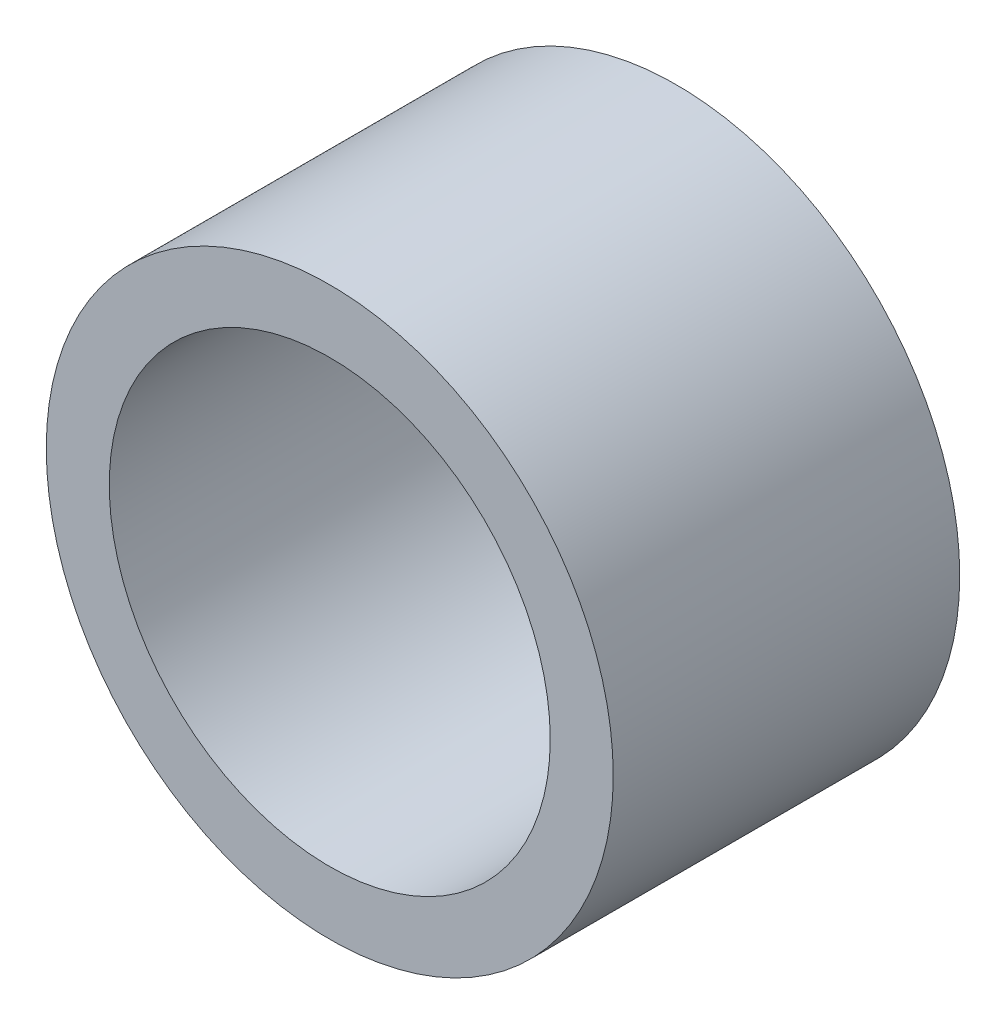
SolidWorks part; units mm, degrees
ref_plane "Front Plane" through (0, 0, 0) normal (0, 0, 1) x (1, 0, 0)
ref_plane "Top Plane" through (0, 0, 0) normal (0, 1, 0) x (1, 0, 0)
ref_plane "Right Plane" through (0, 0, 0) normal (1, 0, 0) x (0, 0, -1)
sketch "Sketch1" plane through (0, 0, 0) normal (0, 0, 1) x (1, 0, 0)
  circle A0 centre (0, 0) radius 14
  circle A1 centre (0, 0) radius 18
  dimension "D1" = 28
  dimension "D2" = 36
extrude "Extrude1" add sketch "Sketch1" along normal blind 22
